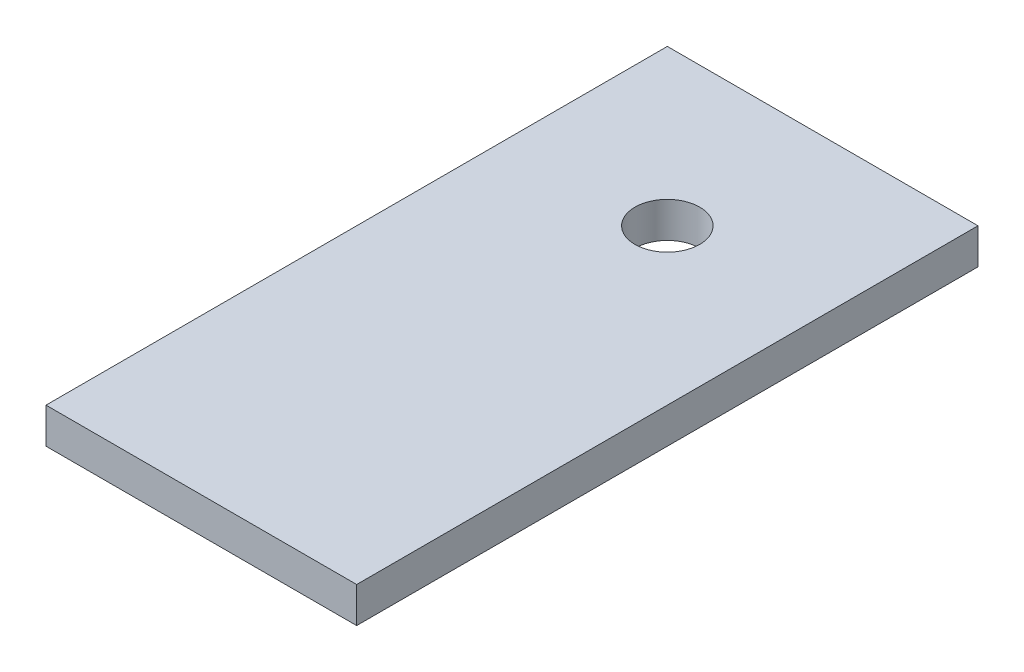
SolidWorks part; units mm, degrees
ref_plane "Front Plane" through (0, 0, 0) normal (0, 0, 1) x (1, 0, 0)
ref_plane "Top Plane" through (0, 0, 0) normal (0, 1, 0) x (1, 0, 0)
ref_plane "Right Plane" through (0, 0, 0) normal (1, 0, 0) x (0, 0, -1)
sketch "Sketch1" plane through (0, 0, 0) normal (0, 0, 1) x (1, 0, 0)
  line L1 (-76.2, -8.7312) -> (76.2, -8.7312)
  line L2 (-76.2, -8.7312) -> (-76.2, 8.7312)
  line L3 (-76.2, 8.7312) -> (76.2, 8.7312)
  line L4 (76.2, -8.7312) -> (76.2, 8.7312)
  line L5 (-76.2, -8.7312) -> (76.2, 8.7312) construction
  line L6 (-76.2, 8.7312) -> (76.2, -8.7312) construction
  point P0 (0, 0)
  dimension "D1" = 17.4625
  dimension "D2" = 152.4
extrude "Boss-Extrude1" add sketch "Sketch1" against normal blind 304.8 contours L3 L4 L1 L2
sketch "Sketch2" plane through (0, 8.7312, 0) normal (0, 1, 0) x (1, 0, 0)
  line L0 (-76.2, 228.6) -> (76.2, 228.6) construction
  line L1 (-76.2, 304.8) -> (-76.2, 0) construction
  line L2 (76.2, 304.8) -> (76.2, 0) construction
  line L3 (0, 304.8) -> (0, 228.6) construction
  line L4 (-76.2, 304.8) -> (76.2, 304.8) construction
  circle A0 centre (0, 228.6) radius 15.875
  dimension "D2" = 31.75
  dimension "D1" = 76.2
extrude "Cut-Extrude1" cut sketch "Sketch2" against normal through all
